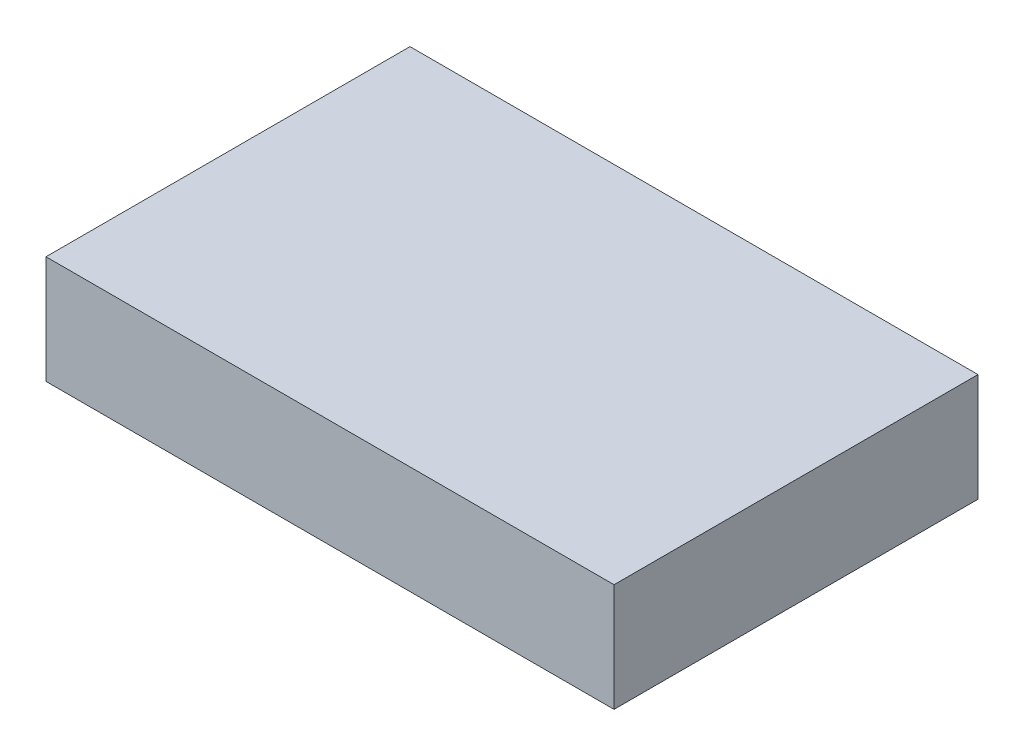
SolidWorks part; units mm, degrees
ref_plane "Front Plane" through (0, 0, 0) normal (0, 0, 1) x (1, 0, 0)
ref_plane "Top Plane" through (0, 0, 0) normal (0, 1, 0) x (1, 0, 0)
ref_plane "Right Plane" through (0, 0, 0) normal (1, 0, 0) x (0, 0, -1)
sketch "Sketch1" plane through (0, 0, 0) normal (0, 1, 0) x (1, 0, 0)
  line L0 (86.7956, -55.6147) -> (-86.7956, 55.6147) construction
  line L1 (-86.7956, 55.6147) -> (86.7956, 55.6147)
  line L2 (-86.7956, 55.6147) -> (-86.7956, -55.6147)
  line L3 (-86.7956, -55.6147) -> (86.7956, -55.6147)
  line L4 (86.7956, 55.6147) -> (86.7956, -55.6147)
extrude "Extrude1" add sketch "Sketch1" along normal blind 33
sketch "Sketch3" plane through (0, 33, 0) normal (0, 1, 0) x (-1, 0, 0)
  line L1 (-95.3793, -25.1299) -> (94.237, -25.1299)
  line L2 (-95.3793, -25.1299) -> (-95.3793, 24.5587)
  line L3 (-95.3793, 24.5587) -> (94.237, 24.5587)
  line L4 (94.237, -25.1299) -> (94.237, 24.5587)
